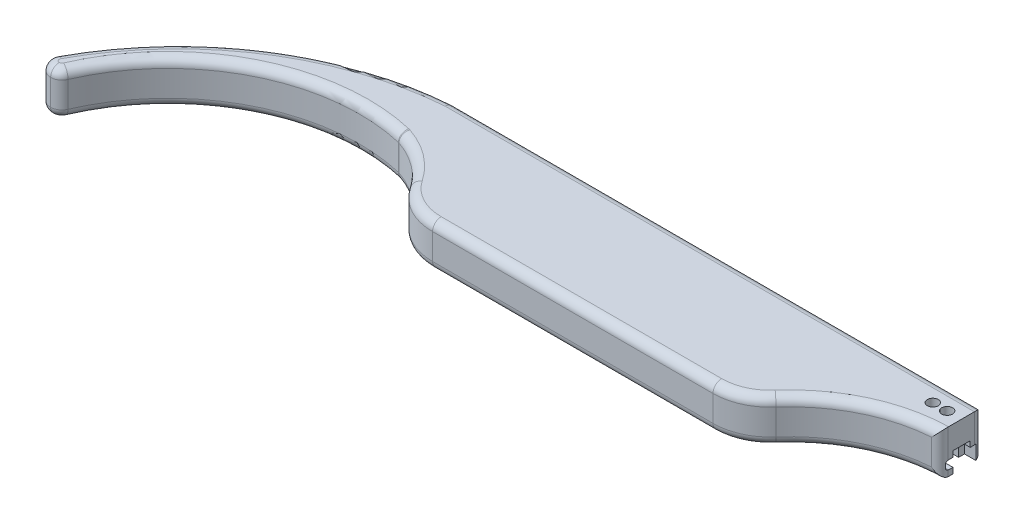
SolidWorks part; units mm, degrees
ref_plane "Front Plane" through (0, 0, 0) normal (0, 0, 1) x (1, 0, 0)
ref_plane "Top Plane" through (0, 0, 0) normal (0, 1, 0) x (1, 0, 0)
ref_plane "Right Plane" through (0, 0, 0) normal (1, 0, 0) x (0, 0, -1)
sketch "Sketch1" plane through (0, 0, 0) normal (0, 1, 0) x (1, 0, 0)
  line L5 (0, 0) -> (-87.5, 0)
  line L6 (0, 0) -> (0, -7.5)
  line L7 (-87.5, 0) -> (-87.5, -20) construction
  line L8 (-87.5, -20) -> (-22.5, -20)
  line L9 (-22.5, -20) -> (-22.5, 0) construction
  line L10 (-87.5, 0) -> (-97.6496, 0)
  line L11 (-97.6496, 0) -> (-97.6496, -4.8809) construction
  line L21 (-140.997, -30) -> (-136.4539, -30)
  arc A3 (0, -7.5) -> (-22.5, -20) centre (0, -34) ccw
  arc A9 (-97.6496, 0) -> (-140.997, -30) centre (-93.8803, -51.7629) ccw
  arc A10 (-136.4539, -30) -> (-97.6496, -9.5454) centre (-105.3361, -41.9984) cw
  arc A11 (-97.6496, -9.5454) -> (-87.5, -20) centre (-102.5353, -24.4426) cw
  dimension "D1" = 20
  dimension "D5" = 30
  dimension "D2" = 7.5
  dimension "D3" = 65
  dimension "D17" = 22.5
extrude "Boss-Extrude1" add sketch "Sketch1" along normal blind 7.5
fillet "Fillet1" radius 10 2 edges at (-22.5, 3.75, 20) (-87.5, 3.75, 20)
fillet "Fillet2" radius 2 2 edges at (-140.997, 3.75, 30) (-136.4539, 3.75, 30)
sketch "Sketch2" plane through (0, 0, 0) normal (0, -1, 0) x (1, 0, 0)
  line L1 (-76.304, 16.7113) -> (-42.304, 16.7113)
  line L2 (-76.304, 16.7113) -> (-76.304, 2.7113)
  line L3 (-76.304, 2.7113) -> (-42.304, 2.7113)
  line L4 (-42.304, 16.7113) -> (-42.304, 2.7113)
  dimension "D1" = 34
  dimension "D2" = 14
  dimension "D3" = 5
extrude "Cut-Extrude1" cut sketch "Sketch2" against normal blind 6
sketch "Sketch3" plane through (-42.304, 0, 0) normal (-1, 0, 0) x (0, 0, 1)
  line L1 (4.5, 5) -> (6, 5)
  line L2 (4, 4.5) -> (4, 3)
  line L3 (4.5, 2.5) -> (6, 2.5)
  line L4 (6.5, 4.5) -> (6.5, 3)
  line L6 (7.5, 3.75) -> (0, 3.75) construction
  line L7 (7.5, 7.5) -> (7.5, 0) construction
  line L8 (0, 7.5) -> (0, 0) construction
  arc A0 (4, 3) -> (4.5, 2.5) centre (4.5, 3) ccw
  arc A1 (6, 2.5) -> (6.5, 3) centre (6, 3) ccw
  arc A2 (6, 5) -> (6.5, 4.5) centre (6, 4.5) cw
  arc A3 (4.5, 5) -> (4, 4.5) centre (4.5, 4.5) ccw
  point P10 (4, 3.75)
  point P15 (6.5, 2.5)
  point P18 (6.5, 5)
  point P21 (4, 5)
  dimension "D4" = 0.5
  dimension "D5" = 0.5
  dimension "D6" = 0.5
  dimension "D7" = 0.5
  dimension "D1" = 2.5
  dimension "D2" = 2.5
  dimension "D3" = 4
extrude "Cut-Extrude2" cut sketch "Sketch3" against normal up to surface (42.304 mm away)
sketch "Sketch6" plane through (0, 0, 0) normal (0, -1, 0) x (1, 0, 0)
  line L0 (-42.304, 2.7113) -> (-42.304, 16.7113) construction
  line L1 (-76.304, 9.7113) -> (-42.304, 9.7113) construction
  line L2 (-42.304, 2.7113) -> (-42.304, 16.7113) construction
  line L3 (-76.304, 16.7113) -> (-76.304, 2.7113) construction
  line L4 (-39.804, 7.2113) -> (-42.304, 7.2113)
  line L5 (-39.804, 12.2113) -> (-42.304, 12.2113)
  line L6 (-59.304, 9.7113) -> (-59.304, 16.7113) construction
  line L7 (-42.304, 16.7113) -> (-76.304, 16.7113) construction
  line L8 (-78.804, 12.2113) -> (-76.304, 12.2113)
  line L9 (-78.804, 7.2113) -> (-76.304, 7.2113)
  circle A1 centre (-39.804, 9.7113) radius 2.5
  circle A2 centre (-78.804, 9.7113) radius 2.5
  point P6 (-42.304, 9.7113)
  dimension "D1" = 5
extrude "Cut-Extrude3" cut sketch "Sketch6" against normal blind 1 contours A2 L9 M6 | A2 | L8 A2 M6 | A1 | A1 L5 M8 | A1 L4 M8
sketch "Sketch7" plane through (0, 0, 0) normal (0, -1, 0) x (1, 0, 0)
  line L0 (-81.304, 9.7113) -> (-78.804, 9.7113) construction
  line L1 (-59.304, 16.7113) -> (-59.304, 2.7113) construction
  line L2 (-42.304, 16.7113) -> (-76.304, 16.7113) construction
  line L3 (-76.304, 2.7113) -> (-42.304, 2.7113) construction
  circle A0 centre (-78.804, 9.7113) radius 1.6
  arc A1 (-78.804, 12.2113) -> (-78.804, 7.2113) centre (-78.804, 9.7113) ccw construction
  circle A2 centre (-39.804, 9.7113) radius 1.6
  dimension "D1" = 3.2
extrude "Cut-Extrude4" cut sketch "Sketch7" against normal blind 3
sketch "Sketch8" plane through (0, 0, 0) normal (0, -1, 0) x (1, 0, 0)
  line L0 (0, 7.5) -> (0, 0) construction
  circle A0 centre (-5.5, 3.75) radius 0.75
  circle A1 centre (-3, 3.75) radius 0.75
  point P6 (0, 3.75)
  dimension "D1" = 1.5
  dimension "D2" = 2.5
  dimension "D3" = 3
extrude "Cut-Extrude5" cut sketch "Sketch8" against normal blind 2
fillet "Fillet3" radius 1.5 24 edges at (-10.9658, 7.5, 9.8753) (-23.362, 7.5, 19.1037) (-10.9658, 0, 9.8753) (-23.362, 0, 19.1037) (-54.402, 7.5, 20) (-54.402, 0, 20) (-122.0431, 7.5, 8.1686) (-139.4821, 7.5, 29.0153) (-136.6902, 7.5, 29.6656) (-120.3077, 7.5, 12.1968) (-122.0431, 0, 8.1686) (-139.4821, 0, 29.0153) (-136.6902, 0, 29.6656) (-120.3077, 0, 12.1968) (0, 3.75, 0) (-48.8248, 7.5, 0) (-97.6496, 3.75, 0) (-48.8248, 0, 0) (-97.6496, 3.75, 9.5454) (-93.1075, 7.5, 11.9161) (-93.1075, 0, 11.9161) (0, 3.75, 7.5) (-85.9814, 0, 18.8387) (-85.9814, 7.5, 18.8387)
sketch "Sketch9" plane through (0, 6, 0) normal (0, -1, 0) x (1, 0, 0)
  line L0 (-42.304, 12.2113) -> (-42.304, 16.7113) construction
  line L1 (-76.304, 16.7113) -> (-42.304, 16.7113)
  line L2 (-76.304, 16.7113) -> (-76.304, 15.7113)
  line L3 (-76.304, 15.7113) -> (-42.304, 15.7113)
  line L4 (-42.304, 16.7113) -> (-42.304, 15.7113)
  line L5 (-76.304, 9.7113) -> (-42.304, 9.7113) construction
  line L6 (-76.304, 7.2113) -> (-76.304, 12.2113) construction
  line L7 (-42.304, 12.2113) -> (-42.304, 7.2113) construction
  line L8 (-42.304, 2.7113) -> (-42.304, 3.7113)
  line L9 (-76.304, 3.7113) -> (-42.304, 3.7113)
  line L10 (-76.304, 2.7113) -> (-76.304, 3.7113)
  line L11 (-76.304, 2.7113) -> (-42.304, 2.7113)
  dimension "D1" = 1
extrude "Boss-Extrude2" add sketch "Sketch9" along normal up to surface (5 mm away)
other "Move Face1" parameters "D1"=0.2
other "DeleteFace1"
other "Move Face2" parameters "D1"=0.5
fillet "Fillet4" radius 1.5 2 edges at (-0.5, 3.75, 7.5047) (-0.5, 3.75, 0)
other "Move Face3" parameters "D1"=0.5
other "Move Face4" parameters "D1"=5
other "Move Face5" parameters "D1"=1.5
other "Move Face6" parameters "D1"=1.5
other "Move Face7" parameters "D1"=1
sketch "Sketch10" plane through (0, 0.5, 0) normal (0, -1, 0) x (1, 0, 0)
  circle A1 centre (-3, 3.75) radius 0.95
  circle A2 centre (-3, 3.75) radius 0.95
  circle A3 centre (-5.5, 3.75) radius 0.95
  circle A4 centre (-5.5, 3.75) radius 0.95
  dimension "D1" = 0
  dimension "D2" = 0
extrude "Cut-Extrude6" cut sketch "Sketch10" against normal through all
sketch "Sketch11" plane through (0, 0, 0) normal (0, -1, 0) x (1, 0, 0)
  line L0 (0.488, 2.25) -> (0.488, 5.25)
  line L1 (0.488, 5.25) -> (-6.5, 5.25)
  line L2 (-6.5, 5.25) -> (-6.5, 2.25) construction
  line L3 (-6.5, 2.25) -> (0.488, 2.25)
  line L4 (-5.5, 3.75) -> (0.488, 3.75) construction
  circle A0 centre (-5.5, 3.75) radius 0.95 construction
  circle A1 centre (-5.5, 3.75) radius 0.95 construction
  arc A2 (-6.5, 2.25) -> (-6.5, 5.25) centre (-6.5, 3.75) cw
  dimension "D1" = 3
  dimension "D2" = 1
extrude "Cut-Extrude7" cut sketch "Sketch11" against normal blind 3.5
sketch "Sketch12" plane through (0, 0, 0) normal (0, -1, 0) x (1, 0, 0)
  line L1 (-0.5, 2.25) -> (-2.5, 2.25)
  line L2 (-0.5, 2.25) -> (-0.5, 1.25)
  line L3 (-0.5, 1.25) -> (-2.5, 1.25)
  line L4 (-2.5, 2.25) -> (-2.5, 1.25)
  dimension "D1" = 2
  dimension "D2" = 1
extrude "Cut-Extrude8" cut sketch "Sketch12" against normal up to surface (2.5 mm away)
other "Move Face8" parameters "D1"=16
other "Move Face9" parameters "D1"=2
equation "\"PCB_width\"= 10mm"
equation "\"PCB_length\"= 30mm"
equation "\"PCB_depth\"= 5mm"
equation "\"battery length\"= 25mm"
equation "\"battery width\"= 10mm"
equation "\"battery thickness\"= 5mm"
equation "\"D1@Cut-Extrude1\"=\"pocket thickness\""
equation "\"pocket length\"= \"battery length\" + 2mm"
equation "\"pocket width\"= \"battery width\" + 2mm"
equation "\"pocket thickness\"= \"battery thickness\" + 1mm"
